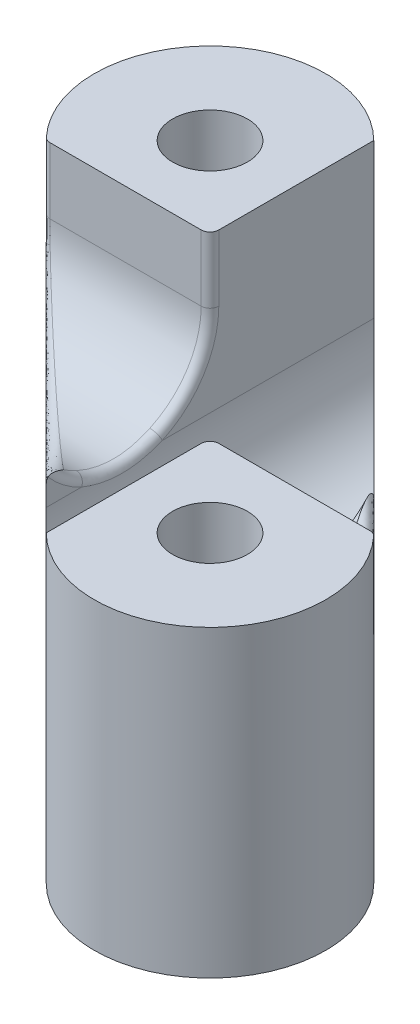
SolidWorks part; units mm, degrees
ref_plane "Спереди" through (0, 0, 0) normal (0, 0, 1) x (1, 0, 0)
ref_plane "Сверху" through (0, 0, 0) normal (0, 1, 0) x (1, 0, 0)
ref_plane "Справа" through (0, 0, 0) normal (1, 0, 0) x (0, 0, -1)
sketch "Эскиз1" plane through (0, 0, 0) normal (0, 1, 0) x (1, 0, 0)
  line L0 (-16.9094, 6.02) -> (-0.797, 6.02) construction
  line L1 (-4, 22.7767) -> (4, 22.7767) construction
  line L2 (-4, 22.7767) -> (-4, -22.7767) construction
  line L3 (-4, -22.7767) -> (4, -22.7767) construction
  line L4 (4, 22.7767) -> (4, -22.7767) construction
  line L5 (-22.7767, 4) -> (22.7767, 4) construction
  line L6 (-22.7767, 4) -> (-22.7767, -4) construction
  line L7 (-22.7767, -4) -> (22.7767, -4) construction
  line L8 (22.7767, 4) -> (22.7767, -4) construction
  line L9 (-6.02, 15.0974) -> (-6.02, 1.8458) construction
  line L10 (0, 0) -> (12.3139, 12.3139) construction
  line L11 (-4, 11.44) -> (11.44, -4)
  line L12 (-11.44, 4) -> (4, -11.44)
  circle A0 centre (-7.72, 7.72) radius 1.7
  circle A2 centre (-7.72, 7.72) radius 5.2609
  circle A3 centre (7.72, -7.72) radius 1.7
  circle A4 centre (7.72, -7.72) radius 5.2609
  point P8 (-22.7767, 0)
  point P9 (-4, 0)
  point P11 (0, 4)
  point P12 (0, 22.7767)
  dimension "D2" = 3.4
  dimension "D4" = 2.02
  dimension "D3" = 2.02
  dimension "D1" = 8
  dimension "D5" = 45
extrude "Бобышка-Вытянуть1" add sketch "Эскиз1" along normal blind 13.8 contours L12 A4 L11 A2 | A4 A3 | A2 A0
sketch "Эскиз2" plane through (0, 0, 0) normal (0, 0, 1) x (1, 0, 0)
  line L0 (17.3092, 0) -> (17.3092, 2.8) construction
  line L1 (17.3092, 2.8) -> (17.3092, 6.8) construction
  line L2 (17.3092, 2.8) -> (-8.8711, 2.8) construction
  line L3 (-4, 6.8) -> (-4, 21.4045)
  line L4 (-4, 21.4045) -> (4, 21.4045)
  line L5 (4, 21.4045) -> (4, 6.8)
  arc A0 (-4, 6.8) -> (4, 6.8) centre (0, 6.8) ccw
  point P4 (0, 0)
  dimension "D2" = 8
  dimension "D1" = 2.8
extrude "Вырез-Вытянуть1" cut sketch "Эскиз2" against normal through all both and the other way through all
sketch "Эскиз3" plane through (0, 0, 0) normal (1, 0, 0) x (0, 0, -1)
  line L0 (11.44, 16.2182) -> (7.44, 16.2182)
  line L1 (7.44, 16.2182) -> (0, 16.2182)
  line L2 (0, 16.2182) -> (-4, 16.2182)
  line L3 (-4, 16.2182) -> (-4, -1.7197)
  line L4 (4, 16.2182) -> (4, -0.1946)
  line L5 (15.6886, 6.8) -> (15.6886, 10.8)
  circle A0 centre (0, 10.8) radius 4
  point P12 (0, 0)
  point P15 (0, 0)
  point P16 (0, 0)
  point P17 (0, 0)
  point P18 (0, 9.2749)
  point P19 (0, 0)
  point P20 (0, 0)
  dimension "D1" = 8
extrude "Вырез-Вытянуть2" cut sketch "Эскиз3" against normal through all both and the other way through all contours A0 | A0 L4 L1 L2 L3
fillet "Скругление1" radius 0.4 10 edges at (4, 12.3, 4) (4, 7.9716, 2.8284) (11.44, 12.3, 4) (-4, 12.3, -4) (-4, 7.9716, -2.8284) (-11.44, 12.3, -4) (4, 7.324, -1.9793) (8.4983, 6.9425, 1.0583) (-4, 7.324, 1.9793) (-8.4983, 6.9425, -1.0583)
sketch "Эскиз4" plane through (0, 13.8, 0) normal (0, 1, 0) x (1, 0, 0)
  line L1 (-0.22, 13.3605) -> (0.22, 13.3605) construction
  line L2 (-0.22, 13.3605) -> (-0.22, -14.1198) construction
  line L3 (-0.22, -14.1198) -> (0.22, -14.1198) construction
  line L4 (0.22, 13.3605) -> (0.22, -14.1198) construction
  circle A0 centre (-7.72, 7.72) radius 7.5
  circle A1 centre (7.72, -7.72) radius 7.5
  dimension "D1" = 21.8355
  dimension "D2" = 15
  dimension "D4" = 0.44
